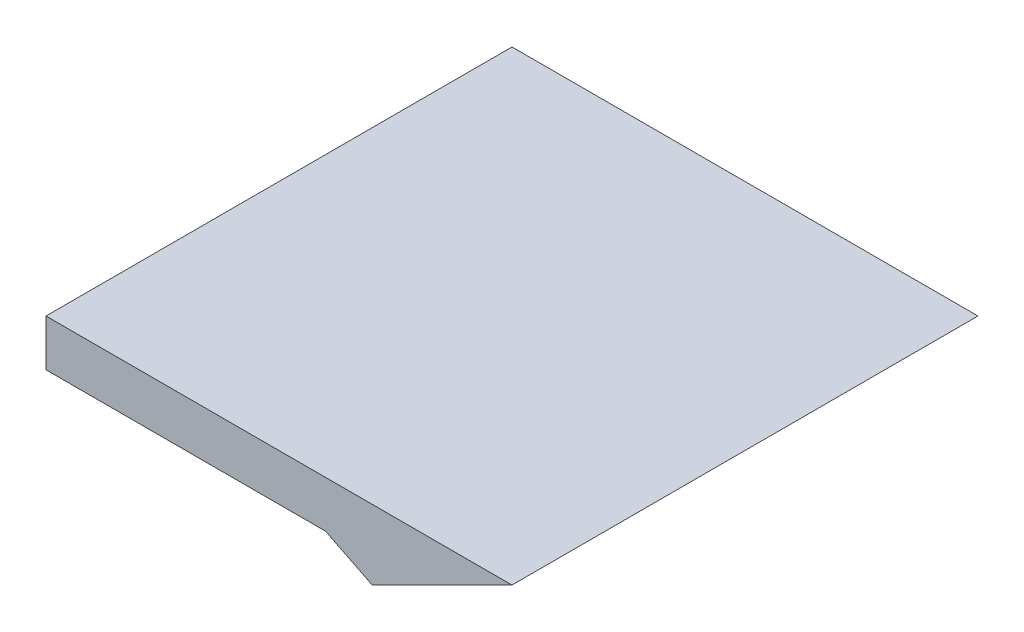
SolidWorks part; units mm, degrees
ref_plane "Plan de face" through (0, 0, 0) normal (0, 0, 1) x (1, 0, 0)
ref_plane "Plan de dessus" through (0, 0, 0) normal (0, 1, 0) x (1, 0, 0)
ref_plane "Plan de droite" through (0, 0, 0) normal (1, 0, 0) x (0, 0, -1)
sketch "Esquisse1" plane through (0, 0, 0) normal (0, 0, 1) x (1, 0, 0)
  line L0 (-23.3771, 0) -> (-17.3771, 0)
  line L2 (-23.3771, 0) -> (-23.3771, 1)
  line L3 (-23.3771, 1) -> (-13.3771, 1)
  line L4 (-16.3771, -0.5) -> (-13.3771, 1)
  line L5 (-16.3771, -0.5) -> (-17.3771, 0)
extrude "Boss.-Extru.1" add sketch "Esquisse1" along normal blind 10
